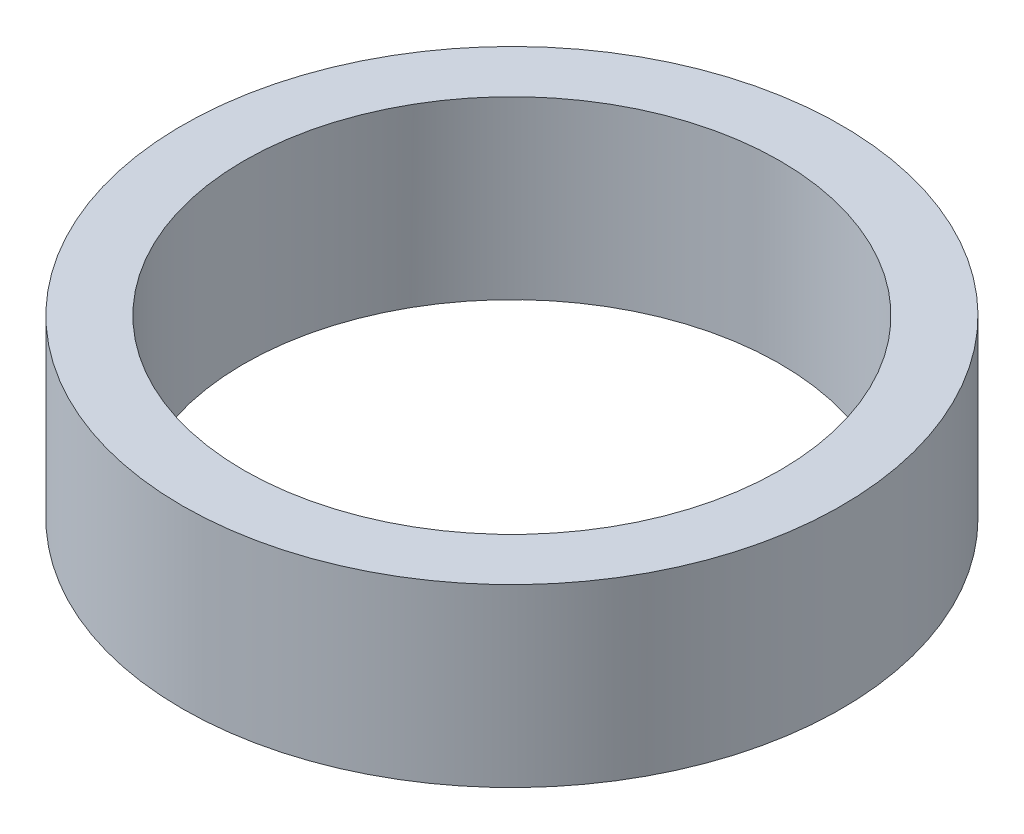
SolidWorks part; units mm, degrees
ref_plane "Front Plane" through (0, 0, 0) normal (0, 0, 1) x (1, 0, 0)
ref_plane "Top Plane" through (0, 0, 0) normal (0, 1, 0) x (1, 0, 0)
ref_plane "Right Plane" through (0, 0, 0) normal (1, 0, 0) x (0, 0, -1)
sketch "Sketch1" plane through (0, 0, 0) normal (0, 1, 0) x (1, 0, 0)
  circle A0 centre (0, 0) radius 4.7625
  circle A1 centre (0, 0) radius 3.8735
  dimension "D1" = 0.889
  dimension "D2" = 9.525
extrude "Boss-Extrude1" add sketch "Sketch1" against normal up to surface (2.54 mm away)
